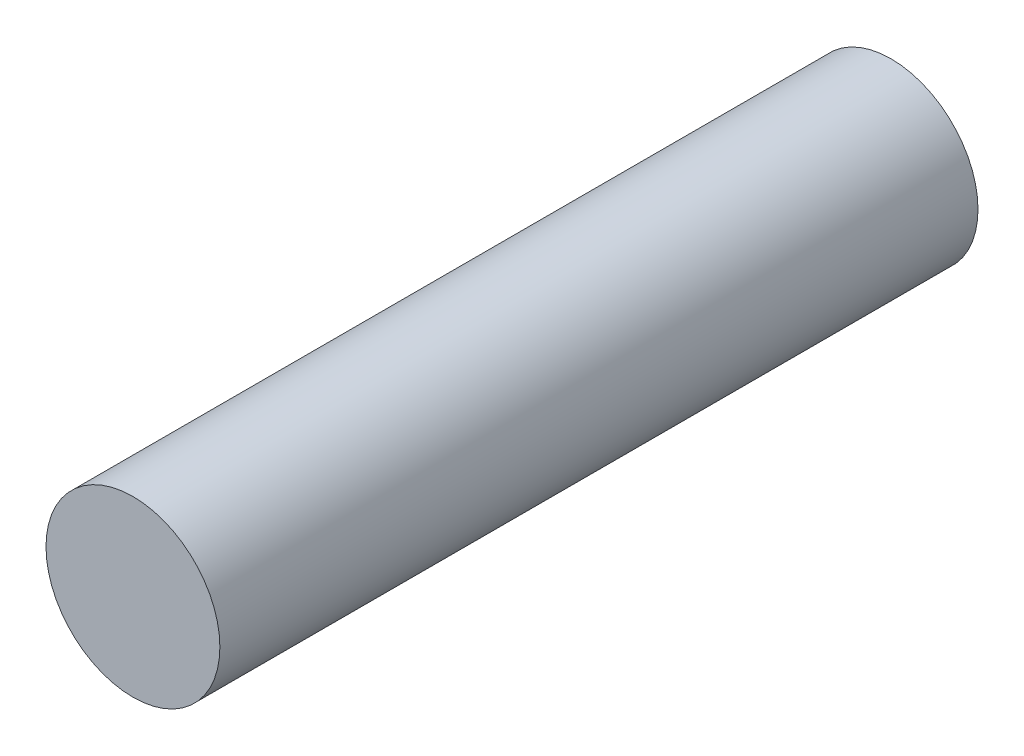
SolidWorks part; units mm, degrees
ref_plane "Front Plane" through (0, 0, 0) normal (0, 0, 1) x (1, 0, 0)
ref_plane "Top Plane" through (0, 0, 0) normal (0, 1, 0) x (1, 0, 0)
ref_plane "Right Plane" through (0, 0, 0) normal (1, 0, 0) x (0, 0, -1)
sketch "Sketch1" plane through (0, 0, 0) normal (0, 0, 1) x (1, 0, 0)
  circle A0 centre (0, 0) radius 3.175
extrude "Boss-Extrude1" add sketch "Sketch1" along normal blind 27.686
